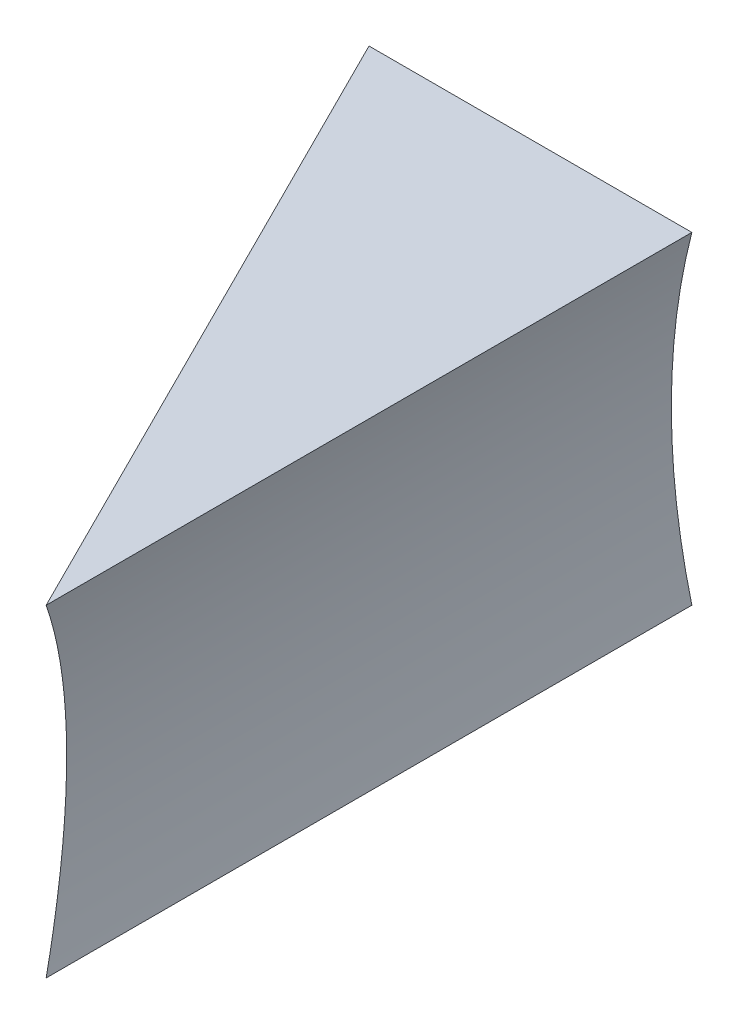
SolidWorks part; units mm, degrees
ref_plane "前视基准面" through (0, 0, 0) normal (0, 0, 1) x (1, 0, 0)
ref_plane "上视基准面" through (0, 0, 0) normal (0, 1, 0) x (1, 0, 0)
ref_plane "右视基准面" through (0, 0, 0) normal (1, 0, 0) x (0, 0, -1)
sketch "草图1" plane through (0, 0, 0) normal (0, 0, 1) x (1, 0, 0)
  line L0 (0, 0) -> (-135.2842, 0) construction
  line L1 (-100, -12.5) -> (-100, 12.5)
  line L2 (-100, 12.5) -> (-48.4123, 12.5)
  line L3 (-100, -12.5) -> (-48.4123, -12.5)
  circle A0 centre (0, 0) radius 50
  dimension "D1" = 100
  dimension "D2" = 25
  dimension "D3" = 100
extrude "拉伸1" add sketch "草图1" along normal blind 50
sketch "草图2" plane through (0, 0, 0) normal (0, 1, 0) x (1, 0, 0)
  line L0 (-48.4123, -50) -> (-73.4123, 0)
  line L1 (-100, 0) -> (-48.4123, 0) construction
  line L2 (-73.4123, 0) -> (-48.4123, 0)
  line L3 (-48.4123, 0) -> (-48.4123, -50)
  dimension "D1" = 25
extrude "切除-拉伸1" cut sketch "草图2" against normal mid plane 60 flip side to cut
